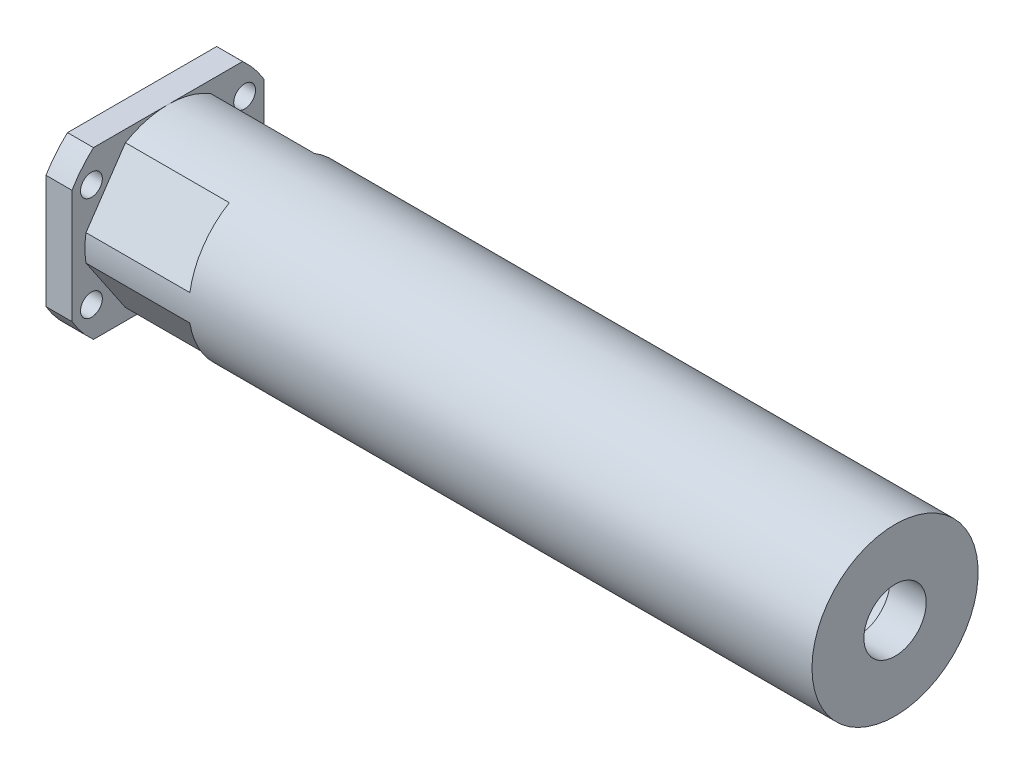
SolidWorks part; units mm, degrees
ref_plane "Plan de face" through (0, 0, 0) normal (0, 0, 1) x (1, 0, 0)
ref_plane "Plan de dessus" through (0, 0, 0) normal (0, 1, 0) x (1, 0, 0)
ref_plane "Plan de droite" through (0, 0, 0) normal (1, 0, 0) x (0, 0, -1)
sketch "Esquisse1" plane through (0, 0, 0) normal (0, 0, 1) x (1, 0, 0)
  line L0 (-102.7743, 0) -> (82.9588, 0) construction
  line L1 (-138, 21.5) -> (-133, 21.5)
  line L2 (7, 16) -> (7, 0)
  line L3 (7, 0) -> (0, 0)
  line L4 (0, 0) -> (0, 13.25)
  line L5 (0, 13.25) -> (-138, 13.25)
  line L6 (-138, 13.25) -> (-138, 21.5)
  line L7 (-133, 21.5) -> (-133, 16)
  line L8 (-133, 16) -> (7, 16)
  dimension "D1" = 145
  dimension "D2" = 7
  dimension "D3" = 43
  dimension "D4" = 26.5
  dimension "D5" = 5
  dimension "D6" = 32
revolve "Révolution1" add sketch "Esquisse1" angle 360 about L0
hole_wizard "Trou taraudé M12x1.751" positions "Esquisse3" profile "Esquisse2" tap size "M12x1.75" standard "ISO"
sketch "Esquisse3" plane through (7, 0, 0) normal (1, 0, 0) x (0, 0, -1)
  line L0 (0, 21.1346) -> (0, -21.1983) construction
  line L1 (-21.0206, 0) -> (25.4432, 0) construction
  point P0 (0, 0)
sketch "Esquisse2" plane through (7, 0, 0) normal (0, 1, 0) x (0, 0, -1)
  line L0 (0, 0) -> (0, 145)
  line L1 (0, 145) -> (6, 145)
  line L2 (6, 145) -> (6, 0)
  line L5 (6, 0) -> (0, 0)
  line L11 (0, -6.35) -> (0, 107.95) construction
  dimension "Diamètre principal du filetage" = 12
  dimension "Profondeur du trou pour taraudage jusqu'au prochain" = 145
sketch "Esquisse5" plane through (-138, 0, 0) normal (-1, 0, 0) x (0, 0, 1)
  line L0 (0, 22.5799) -> (0, -22.5799) construction
  line L1 (-18.5, 16) -> (18.5, 16)
  line L2 (-18.5, 16) -> (-18.5, -16)
  line L3 (-18.5, -16) -> (18.5, -16)
  line L4 (18.5, 16) -> (18.5, -16)
  line L5 (25.0997, 0) -> (-28.1758, 0) construction
  dimension "D1" = 37
  dimension "D2" = 32
extrude "Enlèv. mat.-Extru.2" cut sketch "Esquisse5" against normal through all flip side to cut
sketch "Esquisse8" plane through (-133, 0, 0) normal (1, 0, 0) x (0, 0, -1)
  line L0 (-8.2062, 13.7353) -> (-15.7974, 2.5383)
  line L1 (8.2062, 13.7353) -> (15.7974, 2.5383)
  line L2 (15.9994, 0.1343) -> (8.6135, -13.4836)
  line L3 (-8.2062, -13.7353) -> (-15.7974, -2.5383)
  line L4 (-14.75, -10) -> (14.75, 10) construction
  line L5 (-14.75, 10) -> (0, 0) construction
  line L6 (14.75, -8) -> (0, 0) construction
  arc A0 (15.9994, 0.1343) -> (15.7974, 2.5383) centre (0, 0) ccw
  circle A1 centre (0, 0) radius 16 construction
  arc A2 (-8.2062, -13.7353) -> (8.6135, -13.4836) centre (0, 0) ccw
  arc A3 (-15.7974, 2.5383) -> (-15.7974, -2.5383) centre (0, 0) ccw
  arc A4 (8.2062, 13.7353) -> (-8.2062, 13.7353) centre (0, 0) ccw
  dimension "D1" = 14.5
  dimension "D2" = 14.5
  dimension "D3" = 14
  dimension "D4" = 14.5
extrude "Enlèv. mat.-Extru.4" cut sketch "Esquisse8" along normal blind 20 flip side to cut
sketch "Esquisse9" plane through (-133, 0, 0) normal (1, 0, 0) x (0, 0, -1)
  line L0 (0, 0) -> (-14.7498, 9.9998) construction
  line L1 (0, 0) -> (14.7498, 9.9998) construction
  line L2 (0, 0) -> (14.75, -8) construction
  line L3 (0, 0) -> (-14.7498, -9.9998) construction
  line L4 (-15.7974, -2.5383) -> (-8.2062, -13.7353) construction
  line L5 (-8.2062, 13.7353) -> (-15.7974, 2.5383) construction
  line L6 (8.6135, -13.4836) -> (15.9994, 0.1343) construction
  line L7 (15.7974, 2.5383) -> (8.2062, 13.7353) construction
  line L8 (0, 0) -> (0, -16.4006) construction
  circle A0 centre (0, 0) radius 17.82 construction
  circle A2 centre (0, 0) radius 16 construction
  circle A3 centre (-14.7498, 9.9998) radius 2.1
  circle A4 centre (14.7498, 9.9998) radius 2.1
  circle A5 centre (14.75, -8) radius 2.1
  circle A6 centre (-14.7498, -9.9998) radius 2.1
  dimension "D1" = 35.64
  dimension "D2" = 4.2
  dimension "D3" = 14.75
extrude "Enlèv. mat.-Extru.5" cut sketch "Esquisse9" against normal up to next
sketch "Esquisse10" plane through (-138, 0, 0) normal (-1, 0, 0) x (0, 0, 1)
  circle A0 centre (0, 0) radius 15
  circle A1 centre (0, 0) radius 13.25
  circle A2 centre (0, 0) radius 13.25 construction
  dimension "D1" = 30
extrude "Enlèv. mat.-Extru.6" cut sketch "Esquisse10" against normal blind 1.7
